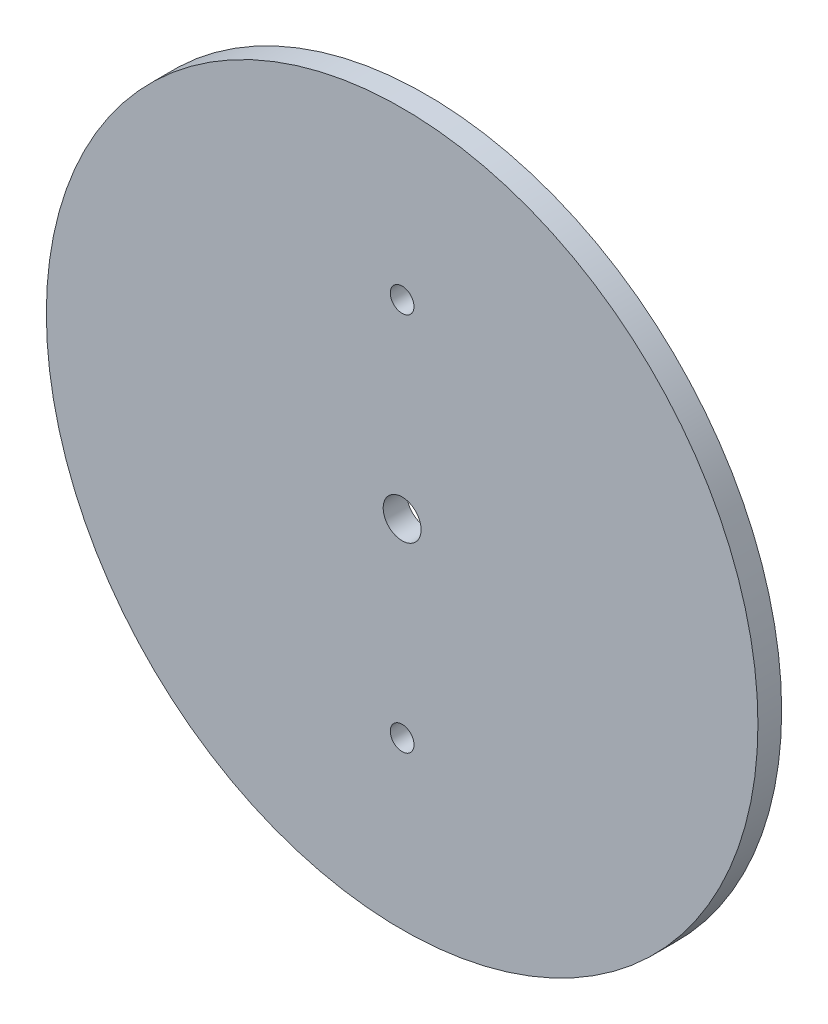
SolidWorks part; units mm, degrees
ref_plane "前视基准面" through (0, 0, 0) normal (0, 0, 1) x (1, 0, 0)
ref_plane "上视基准面" through (0, 0, 0) normal (0, 1, 0) x (1, 0, 0)
ref_plane "右视基准面" through (0, 0, 0) normal (1, 0, 0) x (0, 0, -1)
other "Configuration Table"
sketch "草图1" plane through (0, 0, 0) normal (0, 0, 1) x (1, 0, 0)
  circle A1 centre (0, 0) radius 4
extrude "凸台-拉伸1" add sketch "草图1" along normal blind 70
sketch "草图2" plane through (0, 0, 70) normal (0, 0, 1) x (1, 0, 0)
  circle A0 centre (0, 0) radius 75
  dimension "D1" = 150
extrude "凸台-拉伸2" add sketch "草图2" against normal blind 5
sketch "草图5" plane through (0, 0, 0) normal (0, 0, -1) x (-1, 0, 0)
  circle A0 centre (0, 0) radius 45
  dimension "D1" = 90
extrude "凸台-拉伸3" add sketch "草图5" against normal blind 5 from offset 30
sketch "草图6" plane through (0, 0, 30) normal (0, 0, -1) x (-1, 0, 0)
  circle A0 centre (0, 0) radius 40 construction
  circle A1 centre (0, 40) radius 2.5
  dimension "D1" = 80
  dimension "D2" = 5
extrude "切除-拉伸1" cut sketch "草图6" against normal blind 100
mirror "镜向1" about plane through (0, 0, 0) normal (0, 1, 0) of "切除-拉伸1"
sketch "草图7" plane through (0, 0, 65) normal (0, 0, -1) x (-1, 0, 0)
  circle A1 centre (0, 0) radius 171.376
extrude "切除-拉伸2" cut sketch "草图7" along normal blind 120
sketch "草图9" plane through (0, 0, 65) normal (0, 0, -1) x (-1, 0, 0)
  circle A0 centre (0, 0) radius 4
  dimension "D1" = 8
extrude "切除-拉伸3" cut sketch "草图9" against normal blind 120
